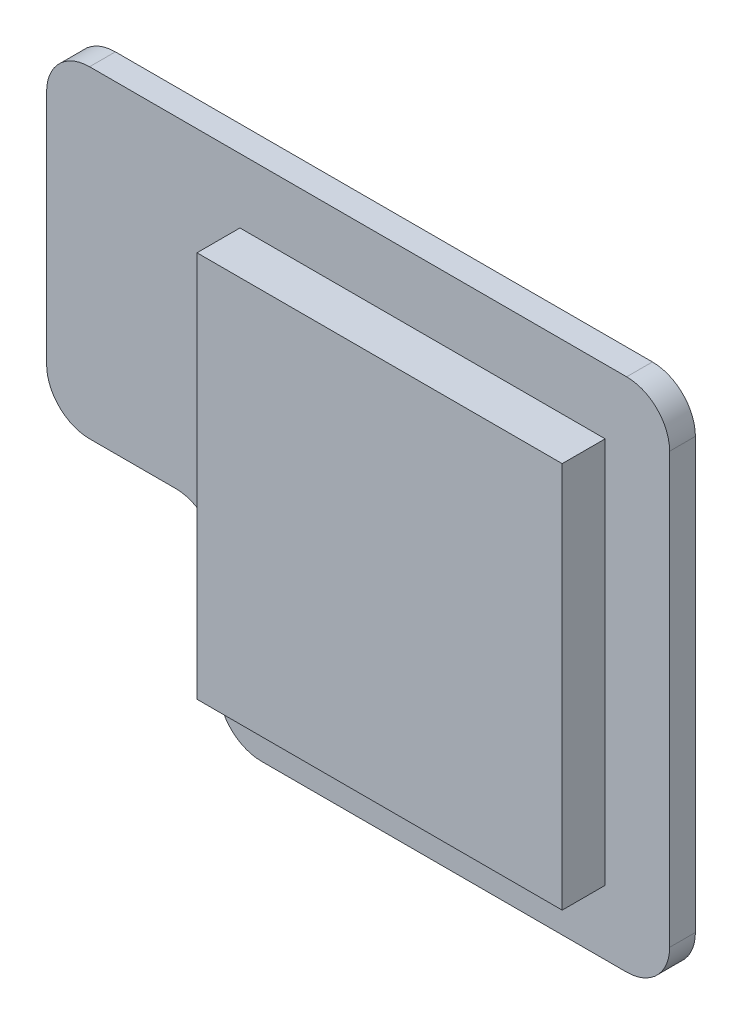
SolidWorks part; units mm, degrees
ref_plane "Plan de face" through (0, 0, 0) normal (0, 0, 1) x (1, 0, 0)
ref_plane "Plan de dessus" through (0, 0, 0) normal (0, 1, 0) x (1, 0, 0)
ref_plane "Plan de droite" through (0, 0, 0) normal (1, 0, 0) x (0, 0, -1)
sketch "Esquisse1" plane through (0, 0, 0) normal (0, 0, 1) x (1, 0, 0)
  line L0 (-80, 95) -> (65, 95)
  line L1 (65, 95) -> (65, -25)
  line L2 (65, -25) -> (-40, -25)
  line L3 (-40, -25) -> (-40, 20)
  line L4 (-40, 20) -> (-80, 20)
  line L5 (-80, 20) -> (-80, 95)
  dimension "D1" = 145
  dimension "D2" = 120
  dimension "D3" = 40
  dimension "D4" = 45
extrude "Extrusion1" add sketch "Esquisse1" along normal blind 6
fillet "Congé1" radius 10 6 edges at (65, -25, 3) (-40, -25, 3) (-40, 20, 3) (-80, 20, 3) (-80, 95, 3) (65, 95, 3)
sketch "Esquisse2" plane through (0, 0, 6) normal (0, 0, 1) x (1, 0, 0)
  line L0 (-40, 10) -> (-40, -15) construction
  line L1 (-35, -10) -> (50, -10)
  line L2 (-35, -10) -> (-35, 80)
  line L3 (-35, 80) -> (50, 80)
  line L4 (50, -10) -> (50, 80)
  line L5 (-30, -25) -> (55, -25) construction
  line L6 (55, 95) -> (-70, 95) construction
  line L7 (65, -15) -> (65, 85) construction
  dimension "D1" = 5
  dimension "D2" = 15
  dimension "D3" = 15
  dimension "D4" = 15
extrude "Extrusion2" add sketch "Esquisse2" along normal blind 10
